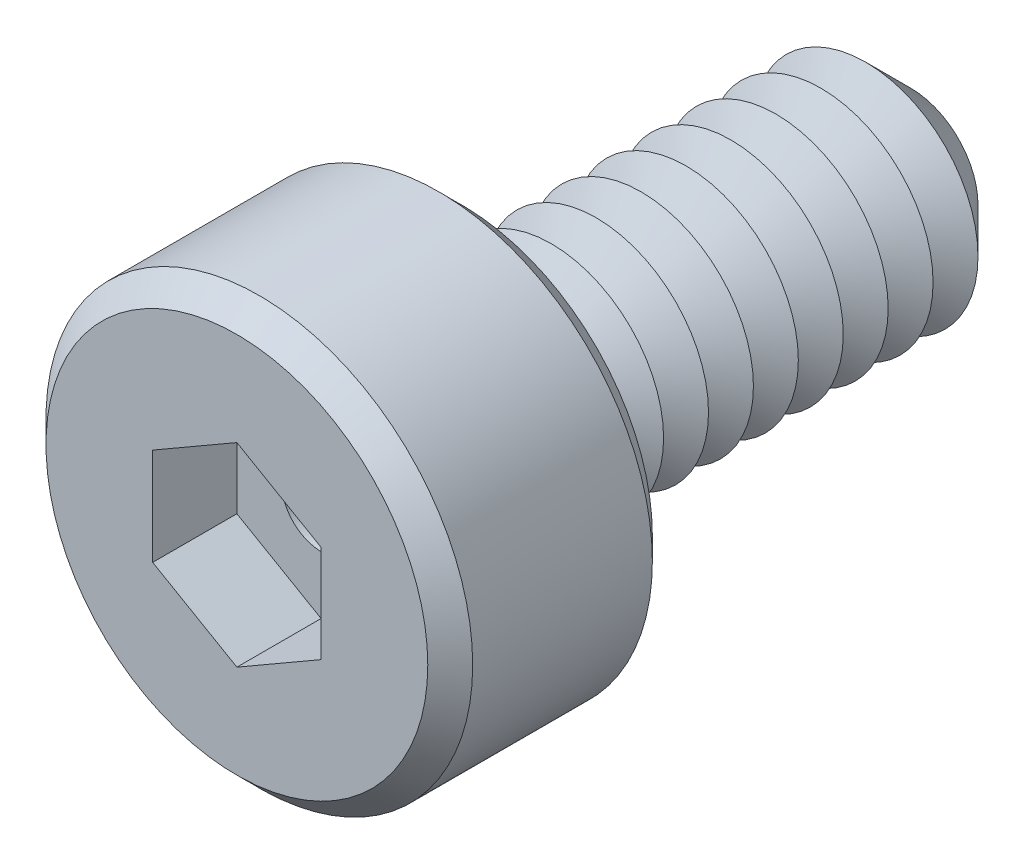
SolidWorks part; units mm, degrees
ref_plane "Front Plane" through (0, 0, 0) normal (0, 0, 1) x (1, 0, 0)
ref_plane "Top Plane" through (0, 0, 0) normal (0, 1, 0) x (1, 0, 0)
ref_plane "Right Plane" through (0, 0, 0) normal (1, 0, 0) x (0, 0, -1)
sketch "Sketch1" plane through (0, 0, 0) normal (0, 0, 1) x (1, 0, 0)
  circle A0 centre (0, 0) radius 1.9
  dimension "D1" = 3.8
extrude "Boss-Extrude1" add sketch "Sketch1" along normal blind 2
sketch "Sketch2" plane through (0, 0, 0) normal (0, 0, -1) x (-1, 0, 0)
  circle A0 centre (0, 0) radius 1
  dimension "D1" = 2
extrude "Boss-Extrude2" add sketch "Sketch2" along normal blind 4
chamfer "Chamfer1" distance 0.4 angle 45 1 edges at (-1, 0, -4)
sketch "Sketch3" plane through (0, 0, 0) normal (1, 0, 0) x (0, 0, -1)
  line L0 (-2.5121, 0) -> (4.5776, 0) construction
sketch "Sketch4" plane through (0, 0, 0) normal (1, 0, 0) x (0, 0, -1)
  line L0 (0, 1) -> (0.2, 0.6536)
  line L1 (0.2, 0.6536) -> (0.4, 1)
  line L2 (3.6, 1) -> (0, 1) construction
  line L3 (0.4, 1) -> (0, 1)
  dimension "D1" = 0.4
revolve "Cut-Revolve1" cut sketch "Sketch4" angle 360 about L0
pattern_linear "LPattern1" count 9 spacing 0.4 along (0, 0, -1) of "Cut-Revolve1"
sketch "Sketch5" plane through (0, 0, 2) normal (0, 0, 1) x (1, 0, 0)
  line L1 (0, 0.866) -> (-0.75, 0.433)
  line L2 (-0.75, 0.433) -> (-0.75, -0.433)
  line L3 (-0.75, -0.433) -> (0, -0.866)
  line L4 (0, -0.866) -> (0.75, -0.433)
  line L5 (0.75, -0.433) -> (0.75, 0.433)
  line L6 (0.75, 0.433) -> (0, 0.866)
  circle A0 centre (0, 0) radius 0.75 construction
  dimension "D1" = 1.5
extrude "Cut-Extrude1" cut sketch "Sketch5" against normal blind 0.75
sketch "Sketch6" plane through (0, 0, 1.25) normal (0, 0, 1) x (1, 0, 0)
  circle A0 centre (0, 0) radius 0.35
  dimension "D1" = 0.7
extrude "Cut-Extrude2" cut sketch "Sketch6" against normal up to surface (5.25 mm away)
chamfer "Chamfer2" distance 0.2 angle 45 2 edges at (1.9, 0, 0) (1.9, 0, 2)
